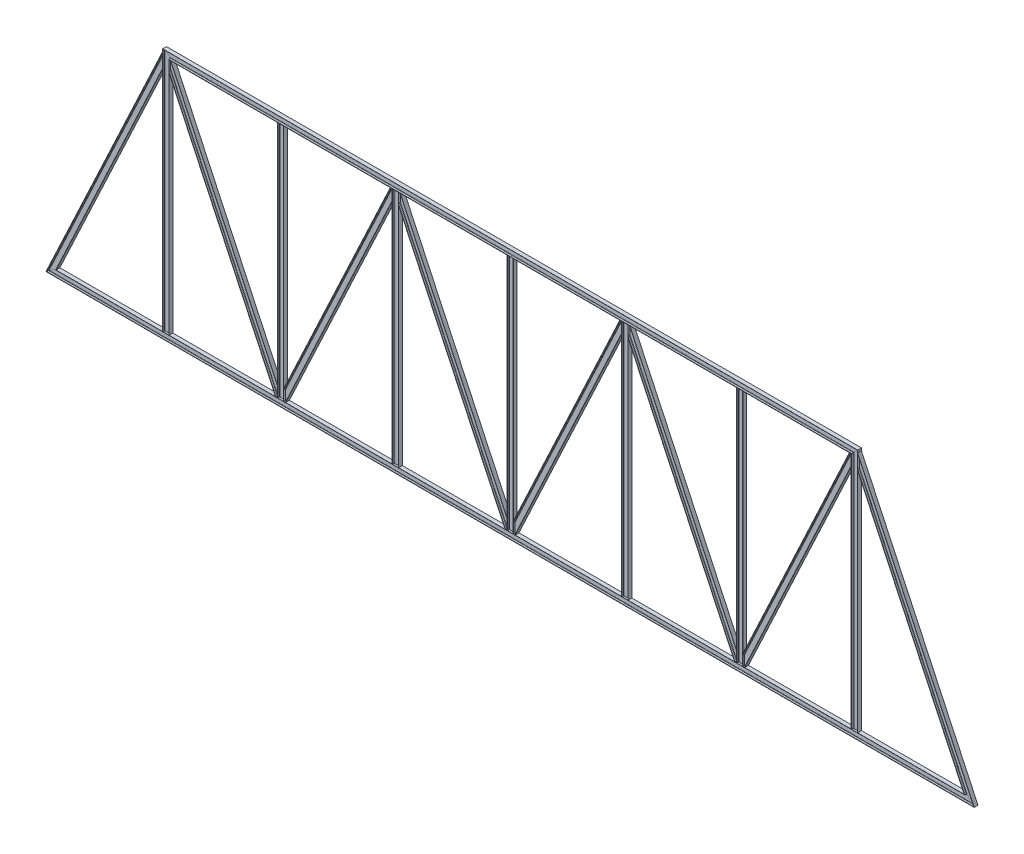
SolidWorks part; units mm, degrees
ref_plane "Front Plane" through (0, 0, 0) normal (0, 0, 1) x (1, 0, 0)
ref_plane "Top Plane" through (0, 0, 0) normal (0, 1, 0) x (1, 0, 0)
ref_plane "Right Plane" through (0, 0, 0) normal (1, 0, 0) x (0, 0, -1)
sketch "Sketch1" plane through (0, 0, 0) normal (0, 0, 1) x (1, 0, 0)
  line L0 (-9144, 0) -> (9144, 0)
  line L1 (-6858, 4876.8) -> (6858, 4876.8)
  line L2 (0, 4876.8) -> (0, 0)
  line L3 (-9144, 0) -> (-6858, 4876.8)
  line L4 (-6858, 4876.8) -> (-4572, 0)
  line L5 (-4572, 0) -> (-2286, 4876.8)
  line L6 (-2286, 4876.8) -> (0, 0)
  line L7 (0, 0) -> (2286, 4876.8)
  line L8 (2286, 4876.8) -> (4572, 0)
  line L9 (4572, 0) -> (6858, 4876.8)
  line L10 (6858, 4876.8) -> (9144, 0)
  line L11 (-6858, 4876.8) -> (-6858, 0)
  line L12 (-4572, 0) -> (-4572, 4876.8)
  line L13 (-2286, 4876.8) -> (-2286, 0)
  line L14 (2286, 4876.8) -> (2286, 0)
  line L15 (4572, 0) -> (4572, 4876.8)
  line L16 (6858, 4876.8) -> (6858, 0)
  dimension "D1" = 18288
  dimension "D2" = 4876.8
other "Structural Member1"
ref_plane "Plane1" through (-9144, 0, 0) normal (1, 0, 0) x (0, 0, -1)
sketch "Sketch12" plane through (-9144, 0, 0) normal (1, 0, 0) x (0, 0, -1)
  line L0 (-38.1, -63.5) -> (-38.1, -60.9617)
  line L1 (-35.3409, -57.7046) -> (-9.2972, -53.3637)
  line L2 (-2.7178, -45.5968) -> (-2.7178, 45.5968)
  line L3 (-9.2972, 53.3637) -> (-35.3409, 57.7046)
  line L4 (-38.1, 60.9617) -> (-38.1, 63.5)
  line L5 (-38.1, 63.5) -> (38.1, 63.5)
  line L6 (38.1, 63.5) -> (38.1, 60.9617)
  line L7 (35.3409, 57.7046) -> (9.2972, 53.3637)
  line L8 (2.7178, 45.5968) -> (2.7178, -45.5968)
  line L9 (9.2972, -53.3637) -> (35.3409, -57.7046)
  line L10 (38.1, -60.9617) -> (38.1, -63.5)
  line L11 (38.1, -63.5) -> (-38.1, -63.5)
  line L15 (-2.7178, 0) -> (2.7178, 0) construction
  arc A0 (-9.2972, -53.3637) -> (-2.7178, -45.5968) centre (-10.5918, -45.5968) ccw
  arc A1 (-2.7178, 45.5968) -> (-9.2972, 53.3637) centre (-10.5918, 45.5968) ccw
  arc A2 (9.2972, 53.3637) -> (2.7178, 45.5968) centre (10.5918, 45.5968) ccw
  arc A3 (2.7178, -45.5968) -> (9.2972, -53.3637) centre (10.5918, -45.5968) ccw
  arc A4 (-35.3409, 57.7046) -> (-38.1, 60.9617) centre (-34.798, 60.9617) cw
  arc A5 (35.3409, 57.7046) -> (38.1, 60.9617) centre (34.798, 60.9617) ccw
  arc A6 (-38.1, -60.9617) -> (-35.3409, -57.7046) centre (-34.798, -60.9617) cw
  arc A7 (38.1, -60.9617) -> (35.3409, -57.7046) centre (34.798, -60.9617) ccw
  point P1 (0, 63.5)
  point P8 (0, -63.5)
  point P21 (0, 0)
  point P34 (0, 0)
  dimension "D7" = 9.463
  dimension "RI" = 7.874
  dimension "D2" = 3.302
  dimension "BF" = 76.2
  dimension "DEPTH" = 127
  dimension "TW" = 5.4356
  dimension "D1" = 91.1936
other "Structural Member2"
ref_plane "Plane2" through (-6858, 4876.8, 0) normal (0, -1, 0) x (1, 0, 0)
sketch "Sketch13" plane through (-6858, 4876.8, 0) normal (0, -1, 0) x (0, 0, -1)
  line L0 (-38.1, -63.5) -> (-38.1, -60.9617)
  line L1 (-35.3409, -57.7046) -> (-9.2972, -53.3637)
  line L2 (-2.7178, -45.5968) -> (-2.7178, 45.5968)
  line L3 (-9.2972, 53.3637) -> (-35.3409, 57.7046)
  line L4 (-38.1, 60.9617) -> (-38.1, 63.5)
  line L5 (-38.1, 63.5) -> (38.1, 63.5)
  line L6 (38.1, 63.5) -> (38.1, 60.9617)
  line L7 (35.3409, 57.7046) -> (9.2972, 53.3637)
  line L8 (2.7178, 45.5968) -> (2.7178, -45.5968)
  line L9 (9.2972, -53.3637) -> (35.3409, -57.7046)
  line L10 (38.1, -60.9617) -> (38.1, -63.5)
  line L11 (38.1, -63.5) -> (-38.1, -63.5)
  line L15 (-2.7178, 0) -> (2.7178, 0) construction
  arc A0 (-9.2972, -53.3637) -> (-2.7178, -45.5968) centre (-10.5918, -45.5968) ccw
  arc A1 (-2.7178, 45.5968) -> (-9.2972, 53.3637) centre (-10.5918, 45.5968) ccw
  arc A2 (9.2972, 53.3637) -> (2.7178, 45.5968) centre (10.5918, 45.5968) ccw
  arc A3 (2.7178, -45.5968) -> (9.2972, -53.3637) centre (10.5918, -45.5968) ccw
  arc A4 (-35.3409, 57.7046) -> (-38.1, 60.9617) centre (-34.798, 60.9617) cw
  arc A5 (35.3409, 57.7046) -> (38.1, 60.9617) centre (34.798, 60.9617) ccw
  arc A6 (-38.1, -60.9617) -> (-35.3409, -57.7046) centre (-34.798, -60.9617) cw
  arc A7 (38.1, -60.9617) -> (35.3409, -57.7046) centre (34.798, -60.9617) ccw
  point P1 (0, 63.5)
  point P8 (0, -63.5)
  point P21 (0, 0)
  point P34 (0, 0)
  dimension "D7" = 9.463
  dimension "RI" = 7.874
  dimension "D2" = 3.302
  dimension "BF" = 76.2
  dimension "DEPTH" = 127
  dimension "TW" = 5.4356
  dimension "D1" = 91.1936
other "Trim/Extend1"
other "Trim/Extend2"
other "Trim/Extend3"
other "Trim/Extend4"
other "Structural Member3"
ref_plane "Plane3" through (-9144, 0, 0) normal (0.4244, 0.9055, 0) x (-0.9055, 0.4244, 0)
sketch "Sketch14" plane through (-9144, 0, 0) normal (0.4244, 0.9055, 0) x (0, 0, -1)
  line L0 (-38.1, -63.5) -> (-38.1, -60.9617)
  line L1 (-35.3409, -57.7046) -> (-9.2972, -53.3637)
  line L2 (-2.7178, -45.5968) -> (-2.7178, 45.5968)
  line L3 (-9.2972, 53.3637) -> (-35.3409, 57.7046)
  line L4 (-38.1, 60.9617) -> (-38.1, 63.5)
  line L5 (-38.1, 63.5) -> (38.1, 63.5)
  line L6 (38.1, 63.5) -> (38.1, 60.9617)
  line L7 (35.3409, 57.7046) -> (9.2972, 53.3637)
  line L8 (2.7178, 45.5968) -> (2.7178, -45.5968)
  line L9 (9.2972, -53.3637) -> (35.3409, -57.7046)
  line L10 (38.1, -60.9617) -> (38.1, -63.5)
  line L11 (38.1, -63.5) -> (-38.1, -63.5)
  line L15 (-2.7178, 0) -> (2.7178, 0) construction
  arc A0 (-9.2972, -53.3637) -> (-2.7178, -45.5968) centre (-10.5918, -45.5968) ccw
  arc A1 (-2.7178, 45.5968) -> (-9.2972, 53.3637) centre (-10.5918, 45.5968) ccw
  arc A2 (9.2972, 53.3637) -> (2.7178, 45.5968) centre (10.5918, 45.5968) ccw
  arc A3 (2.7178, -45.5968) -> (9.2972, -53.3637) centre (10.5918, -45.5968) ccw
  arc A4 (-35.3409, 57.7046) -> (-38.1, 60.9617) centre (-34.798, 60.9617) cw
  arc A5 (35.3409, 57.7046) -> (38.1, 60.9617) centre (34.798, 60.9617) ccw
  arc A6 (-38.1, -60.9617) -> (-35.3409, -57.7046) centre (-34.798, -60.9617) cw
  arc A7 (38.1, -60.9617) -> (35.3409, -57.7046) centre (34.798, -60.9617) ccw
  point P1 (0, 63.5)
  point P8 (0, -63.5)
  point P21 (0, 0)
  point P34 (0, 0)
  dimension "D7" = 9.463
  dimension "RI" = 7.874
  dimension "D2" = 3.302
  dimension "BF" = 76.2
  dimension "DEPTH" = 127
  dimension "TW" = 5.4356
  dimension "D1" = 91.1936
other "Trim/Extend5"
other "Trim/Extend6"
other "Trim/Extend7"
other "Trim/Extend8"
other "Trim/Extend9"
other "Trim/Extend10"
other "Trim/Extend11"
other "Trim/Extend12"
other "Trim/Extend13"
